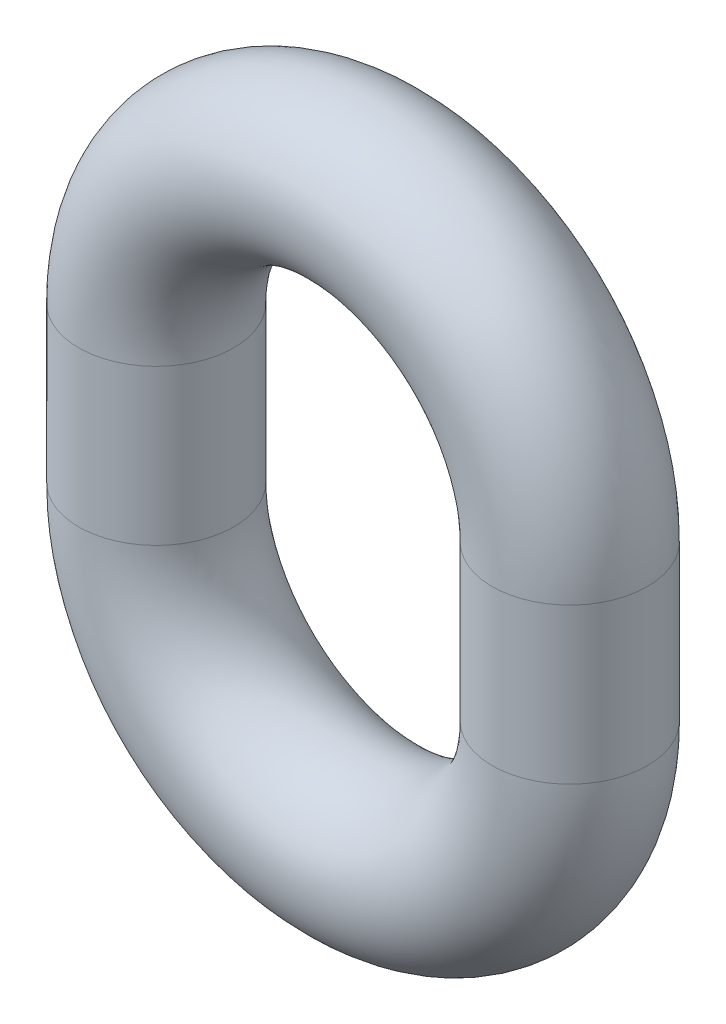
SolidWorks part; units mm, degrees
ref_plane "Face" through (0, 0, 0) normal (0, 0, 1) x (1, 0, 0)
ref_plane "Dessus" through (0, 0, 0) normal (0, 1, 0) x (1, 0, 0)
ref_plane "Droite" through (0, 0, 0) normal (1, 0, 0) x (0, 0, -1)
sketch "Esquisse1" plane through (0, 0, 0) normal (0, 1, 0) x (1, 0, 0)
  circle A0 centre (24, 0) radius 9
  dimension "D1" = 18
  dimension "D2" = 24
sketch "Esquisse2" plane through (0, 0, 0) normal (0, 0, 1) x (1, 0, 0)
  line L2 (24, 9) -> (24, -9)
  line L3 (-24, 9) -> (-24, -9)
  arc A2 (-24, -9) -> (24, -9) centre (0, -9) ccw
  arc A3 (24, 9) -> (-24, 9) centre (0, 9) ccw
  dimension "D5" = 24
  dimension "D1" = 9
  dimension "D2" = 18
sweep "Base-Balayage" add profiles "Esquisse1" path "Esquisse2"
